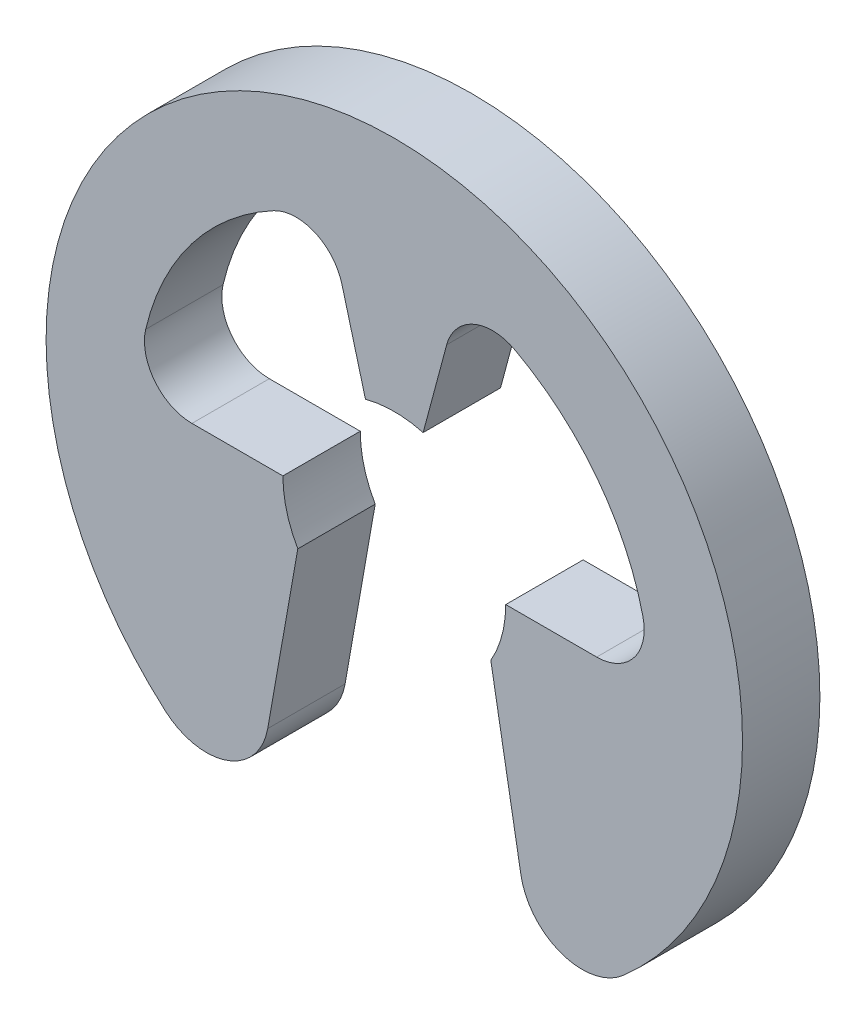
SolidWorks part; units mm, degrees
ref_plane "Plane1" through (0, 0, 0) normal (0, 0, 1) x (1, 0, 0)
ref_plane "Plane2" through (0, 0, 0) normal (0, 1, 0) x (1, 0, 0)
ref_plane "Plane3" through (0, 0, 0) normal (1, 0, 0) x (0, 0, -1)
sketch "Clipboard" plane through (0, 0, 0) normal (0, 0, 1) x (1, 0, 0)
  line L0 (0, 0) -> (0.3, 0)
  circle A0 centre (0, 0) radius 0.32
  circle A1 centre (0, 0) radius 1
  dimension "FreeID" = 0.64
  dimension "FreeOD" = 2
  dimension "Bridge" = 0.3
sketch "BodySke" plane through (0, 0, 0) normal (0, 0, 1) x (1, 0, 0)
  line L0 (-0.7581, 0) -> (0.7581, 0) construction
  line L1 (0, 0) -> (0, 0.36) construction
  line L2 (0, 0) -> (0.1962, 0.7323) construction
  line L3 (0, 0) -> (0.3118, -0.18) construction
  line L4 (0, 0) -> (-0.1962, 0.7323) construction
  line L5 (0, 0) -> (-0.3118, -0.18) construction
  line L6 (0.3118, -0.18) -> (0.409, -0.7316)
  line L7 (-0.3118, -0.18) -> (-0.409, -0.7316)
  line L9 (0.36, 0) -> (0.6538, 0)
  line L10 (-0.36, 0) -> (-0.6538, 0)
  line L11 (0.0932, 0.3477) -> (0.1692, 0.6315)
  line L12 (-0.0932, 0.3477) -> (-0.1692, 0.6315)
  circle A0 centre (0, 0) radius 0.36 construction
  arc A1 (0.8032, 0.1885) -> (0.39, 0.727) centre (0, 0) ccw
  arc A2 (0.739, -0.8482) -> (-0.739, -0.8482) centre (0, 0) ccw
  arc A3 (0.3118, -0.18) -> (0.36, 0) centre (0, 0) ccw
  arc A4 (-0.39, 0.727) -> (-0.8032, 0.1885) centre (0, 0) ccw
  arc A5 (-0.36, 0) -> (-0.3118, -0.18) centre (0, 0) ccw
  arc A6 (-0.0932, 0.3477) -> (0.0932, 0.3477) centre (0, 0) cw
  arc A7 (0.39, 0.727) -> (0.1692, 0.6315) centre (0.3174, 0.5918) ccw
  arc A8 (0.409, -0.7316) -> (0.739, -0.8482) centre (0.607, -0.6967) ccw
  arc A9 (-0.739, -0.8482) -> (-0.409, -0.7316) centre (-0.607, -0.6967) ccw
  arc A10 (-0.8032, 0.1885) -> (-0.6538, 0) centre (-0.6538, 0.1535) ccw
  arc A11 (-0.1692, 0.6315) -> (-0.39, 0.727) centre (-0.3174, 0.5918) ccw
  arc A12 (0.6538, 0) -> (0.8032, 0.1885) centre (0.6538, 0.1535) ccw
  dimension "D1" = 30
  dimension "GrooveDia" = 0.72
  dimension "OutsideDia" = 2.25
  dimension "D3" = 30
  dimension "TipRad" = 0.201
  dimension "CavityDia" = 1.65
  dimension "CavityFilletRad" = 0.1535
  dimension "D4" = 20
extrude "Body" add sketch "BodySke" against normal blind 0.25
equation "' \"FreeID@Clipboard\" = 0.64"
equation "' \"Thickness@Body\" = 0.25"
equation "' \"GrooveDia@BodySke\" = 0.72"
equation "' \"FreeOD@Clipboard\" = 2"
equation "' \"Bridge@Clipboard\" = 0.3"
equation "' \"FreeID@Clipboard\" = 19.5"
equation "' \"Thickness@Body\" = 1.3"
equation "' \"GrooveDia@BodySke\" = 20.00"
equation "' \"FreeOD@Clipboard\" = 37.1"
equation "' \"Bridge@Clipboard\" = 3.3"
equation "\"OutsideDia@BodySke\" = ( \"GrooveDia@BodySke\"  /  \"FreeID@Clipboard\" )  * \"FreeOD@Clipboard\""
equation "\"CavityDia@BodySke\" = \"OutsideDia@BodySke\"  - 2 * \"Bridge@Clipboard\""
equation "\"CavityFilletRad@BodySke\" =  (\"CavityDia@BodySke\" - \"GrooveDia@BodySke\") / 2 * 0.33"
equation "\"TipRad@BodySke\" = 0.67 * \"Bridge@Clipboard\""
